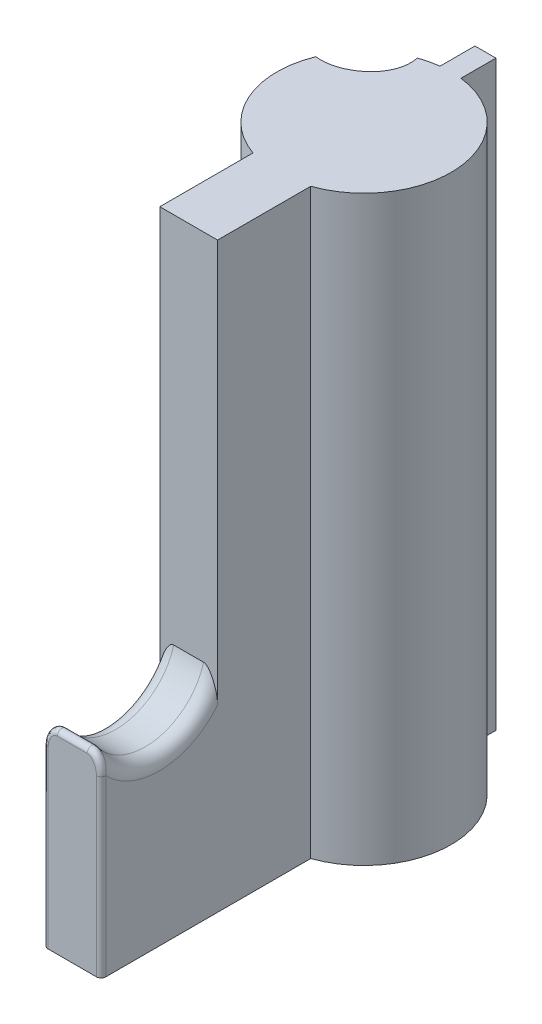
SolidWorks part; units mm, degrees
ref_plane "Plan de face" through (0, 0, 0) normal (0, 0, 1) x (1, 0, 0)
ref_plane "Plan de dessus" through (0, 0, 0) normal (0, 1, 0) x (1, 0, 0)
ref_plane "Plan de droite" through (0, 0, 0) normal (1, 0, 0) x (0, 0, -1)
sketch "Esquisse1" plane through (0, 0, 0) normal (0, 1, 0) x (1, 0, 0)
  line L0 (0, 9.5325) -> (0, -11.6242) construction
  line L1 (-1.24, -3.5285) -> (-1.24, -7.5285)
  line L2 (-1.24, -7.5285) -> (1.24, -7.5285)
  line L3 (1.24, -7.5285) -> (1.24, -3.5285)
  line L4 (-0.45, 5.2128) -> (0.45, 5.2128)
  line L5 (0.45, 5.2128) -> (0.45, 3.7128)
  line L6 (-0.45, 5.2128) -> (-0.45, 3.7128)
  arc A0 (1.24, -3.5285) -> (0.45, 3.7128) centre (0, 0) ccw
  arc A1 (-0.45, 3.7128) -> (-1.24, -3.5285) centre (0, 0) ccw
  point P11 (-0.45, 4.4628)
  dimension "D1" = 1.24
  dimension "D3" = 7.48
  dimension "D2" = 1.24
  dimension "D4" = 4
  dimension "D5" = 0.45
  dimension "D6" = 0.45
  dimension "D7" = 1.5
extrude "lanceur" add sketch "Esquisse1" along normal blind 25
sketch "Esquisse2" plane through (0, 0, 7.5285) normal (0, 0, 1) x (1, 0, 0)
  line L0 (1.24, 25) -> (1.24, 0) construction
  line L1 (-1.24, 0) -> (1.24, 0)
  line L2 (-1.24, 0) -> (-1.24, 9)
  line L3 (-1.24, 9) -> (1.24, 9)
  line L4 (1.24, 0) -> (1.24, 9)
  dimension "D1" = 9
extrude "gachette" add sketch "Esquisse2" along normal blind 5
sketch "Esquisse3" plane through (-1.24, 0, 0) normal (-1, 0, 0) x (0, 0, 1)
  line L0 (7.5285, 9) -> (12.5285, 9)
  arc A0 (7.5285, 9) -> (12.5285, 9) centre (10.0285, 9.7004) ccw
extrude "encoche_gachette" cut sketch "Esquisse3" against normal blind 5
fillet "Congé_encoche1" radius 0.6 2 edges at (1.24, 7.1041, 10.0285) (-1.24, 7.1041, 10.0285)
fillet "Congé_encoche2" radius 0.2 5 edges at (1.24, 3.8544, 12.5285) (0.8559, 8.8632, 12.5285) (-1.24, 3.8544, 12.5285) (-0.7841, 8.9375, 12.5285) (0, 9, 12.5285)
sketch "Esquisse5" plane through (0, 25, 0) normal (0, 1, 0) x (1, 0, 0)
  arc A3 (-0.45, 3.7128) -> (-1.24, -3.5285) centre (0, 0) ccw construction
  arc A4 (-3.4685, 1.3989) -> (-1.2421, 3.5277) centre (-1.2427, 1.2997) cw
  spline S0 degree 3 poles (-3.4685, 1.3989) (-2.3241, 1.2489) (-0.9636, 2.2804) (-1.2421, 3.5277) knots 0 0 0 0 1 1 1 1
extrude "Enlèv. mat.-Extru.7" cut sketch "Esquisse5" against normal blind 10
